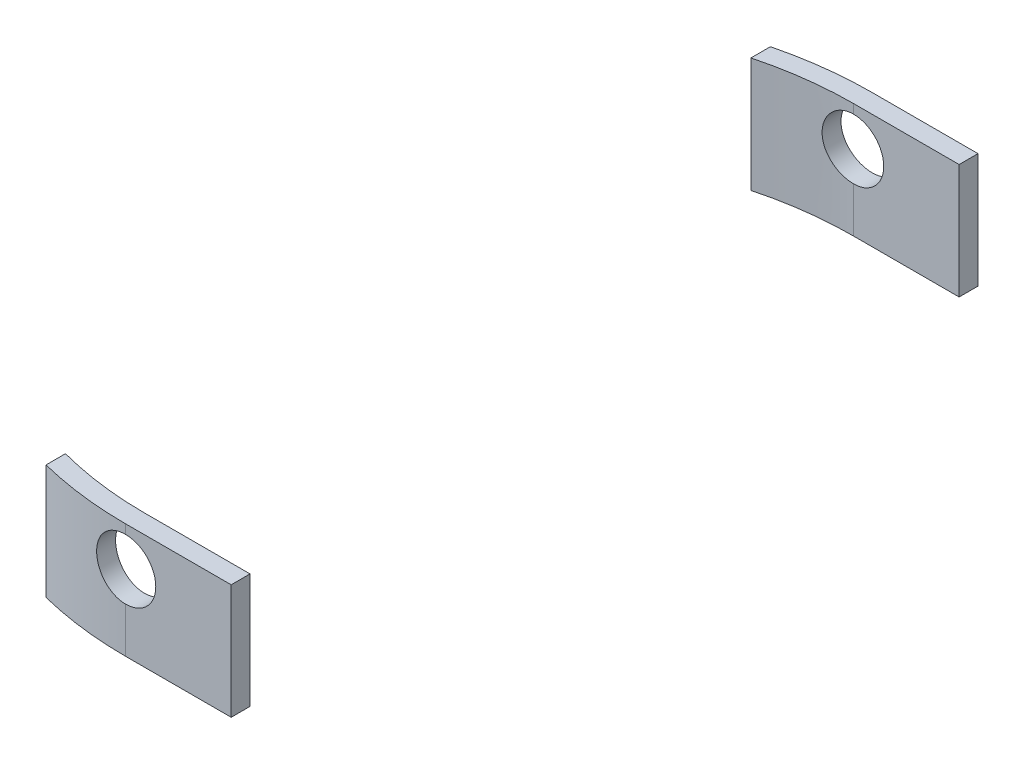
SolidWorks part; units mm, degrees
ref_plane "前视基准面" through (0, 0, 0) normal (0, 0, 1) x (1, 0, 0)
ref_plane "上视基准面" through (0, 0, 0) normal (0, 1, 0) x (1, 0, 0)
ref_plane "右视基准面" through (0, 0, 0) normal (1, 0, 0) x (0, 0, -1)
sketch "草图2" plane through (0, 0, 0) normal (0, 1, 0) x (1, 0, 0)
  line L1 (-25, 25) -> (25, 25)
  line L2 (-25, 25) -> (-25, -25)
  line L3 (-25, -25) -> (25, -25)
  line L4 (25, 25) -> (25, -25)
  line L5 (-25, 25) -> (25, -25) construction
  line L6 (-25, -25) -> (25, 25) construction
  point P0 (0, 0)
extrude "凸台-拉伸2" add sketch "草图2" along normal blind 2
extrude "切除-拉伸4" cut sketch "草图6" against normal up to surface (2 mm away)
sketch "草图6" plane through (19.5662, 2, 0) normal (0, 1, 0) x (1, 0, 0)
  line L0 (-19.5662, -18.5) -> (-11.9669, -18.5)
  line L2 (-11.9669, 18.5) -> (-19.5662, 18.5)
  line L8 (-51.0686, 28.8755) -> (17.3497, 28.8755)
  line L9 (-51.0686, 28.8755) -> (-51.0686, -33.6721)
  line L10 (-51.0686, -33.6721) -> (17.3497, -33.6721)
  line L11 (17.3497, 28.8755) -> (17.3497, -33.6721)
  arc A0 (-19.5662, -18.5) -> (-19.5662, 18.5) centre (-19.5662, 0) cw
  arc A1 (-11.9669, 18.5) -> (-11.9669, -18.5) centre (-19.5662, 0) cw
extrude "切除-拉伸5" cut sketch "草图7" against normal up to surface (2 mm away)
sketch "草图7" plane through (19.5662, 0, 0) normal (0, -1, 0) x (-1, 0, 0)
  line L1 (19.5662, 11.7491) -> (9.3912, 5.8745)
  line L2 (9.3912, 5.8745) -> (9.3912, -5.8745)
  line L3 (9.3912, -5.8745) -> (19.5662, -11.7491)
  line L4 (19.5662, -11.7491) -> (29.7412, -5.8745)
  line L5 (29.7412, -5.8745) -> (29.7412, 5.8745)
  line L6 (29.7412, 5.8745) -> (19.5662, 11.7491)
  circle A0 centre (19.5662, 0) radius 10.175 construction
sketch "草图8" plane through (0, 2, 0) normal (0, 1, 0) x (1, 0, 0)
  line L0 (12.375, 6.8) -> (12.375, -6.8)
  line L2 (0.2519, -13.973) -> (-11.5261, -7.173)
  line L4 (-11.5261, 7.173) -> (0.2519, 13.973)
  line L6 (10.175, 5.8745) -> (10.175, -5.8745) construction
  line L7 (-10.175, 5.8745) -> (0, 11.7491) construction
  line L8 (0, -11.7491) -> (-10.175, -5.8745) construction
  arc A0 (0.2519, -13.973) -> (12.375, -6.8) centre (0.4487, -0.4744) ccw
  arc A1 (12.375, 6.8) -> (0.2519, 13.973) centre (0.4487, 0.4744) ccw
  arc A2 (-11.5261, 7.173) -> (-11.5261, -7.173) centre (-0.6841, 0) ccw
  point P8 (10.175, 0)
  point P9 (12.375, 0)
  dimension "D7" = 13.5
  dimension "D8" = 13.5
  dimension "D9" = 13
  dimension "D1" = 13.6
  dimension "D2" = 13.6
  dimension "D3" = 13.6
  dimension "D4" = 2.2
  dimension "D5" = 1.8
  dimension "D6" = 1.8
extrude "切除-拉伸6" cut sketch "草图8" against normal blind 0.9
sketch "草图9" plane through (0, 2, 0) normal (0, 1, 0) x (1, 0, 0)
  line L0 (7.5993, 18.8) -> (0, 18.8)
  line L1 (7.5993, 18.5) -> (0, 18.5) construction
  line L2 (0, -18.8) -> (7.5993, -18.8)
  line L4 (0, 18.5) -> (7.5993, 18.5)
  line L5 (7.5993, -18.5) -> (0, -18.5)
  arc A0 (0, 18.8) -> (0, -18.8) centre (0, 0) ccw
  arc A1 (7.5993, 18.8) -> (7.5993, -18.8) centre (0, 0) cw
  arc A2 (0, 18.5) -> (0, -18.5) centre (0, 0) ccw
  arc A3 (7.5993, 18.5) -> (7.5993, -18.5) centre (0, 0) cw
  arc A10 (7.5993, -18.5) -> (7.5993, 18.5) centre (0, 0) ccw construction
  dimension "D1" = 0.3
extrude "凸台-拉伸3" add sketch "草图9" against normal up to surface (2 mm away)
sketch "草图11" plane through (0, 2, 0) normal (0, 1, 0) x (1, 0, 0)
  line L0 (7.5993, 19.8) -> (0, 19.8)
  line L2 (0, -19.8) -> (7.5993, -19.8)
  line L3 (7.5993, 18.8) -> (0, 18.8) construction
  line L4 (0, -18.8) -> (7.5993, -18.8) construction
  line L5 (0, 18.8) -> (7.5993, 18.8)
  line L6 (7.5993, -18.8) -> (0, -18.8)
  arc A0 (0, 19.8) -> (0, -19.8) centre (0, 0) ccw
  arc A1 (7.5993, -19.8) -> (7.5993, 19.8) centre (0, 0) ccw
  arc A2 (0, 18.8) -> (0, -18.8) centre (0, 0) ccw
  arc A3 (7.5993, 18.8) -> (7.5993, -18.8) centre (0, 0) cw
  arc A4 (7.5993, -18.8) -> (7.5993, 18.8) centre (0, 0) ccw construction
  dimension "D1" = 1
  dimension "D2" = 1
extrude "凸台-拉伸4" add sketch "草图11" along normal blind 16.3 and the other way up to surface (2 mm away)
sketch "草图12" plane through (0, 18.3, 0) normal (0, 1, 0) x (1, 0, 0)
  line L0 (0, -19.8) -> (7.5993, -19.8) construction
  line L1 (7.5993, 19.8) -> (5.5993, 19.8)
  line L2 (7.5993, 19.8) -> (7.5993, -19.8)
  line L3 (7.5993, -19.8) -> (5.5993, -19.8)
  line L4 (5.5993, 19.8) -> (5.5993, -19.8)
  dimension "D1" = 2
extrude "切除-拉伸8" cut sketch "草图12" against normal blind 11
sketch "草图13" plane through (0, 0, 0) normal (0, -1, 0) x (-1, 0, 0)
  circle A1 centre (-1, 0) radius 23
  circle A2 centre (-1, 0) radius 19.2348
  dimension "D1" = 1
extrude "凸台-拉伸5" add sketch "草图13" against normal blind 0.8
sketch "草图14" plane through (0, 0.8, 0) normal (0, 1, 0) x (1, 0, 0)
  circle A0 centre (1, 0) radius 22.4
  circle A1 centre (1, 0) radius 23
extrude "凸台-拉伸6" add sketch "草图14" along normal blind 4
extrude "切除-拉伸9" cut sketch "草图15" against normal blind 1.2
sketch "草图15" plane through (19.5662, 18.4506, -19.8) normal (0, 0, -1) x (-1, 0, 0)
  circle A0 centre (19.5662, -2.2381) radius 1.6
extrude "切除-拉伸10" cut sketch "草图16" against normal blind 1.2
sketch "草图16" plane through (19.5662, 18.4506, 19.8) normal (0, 0, 1) x (1, 0, 0)
  circle A0 centre (-19.5662, -2.2381) radius 1.6
sketch "草图17" plane through (0, 0, 0) normal (0, -1, 0) x (-1, 0, 0)
  circle A0 centre (0, 0) radius 14
  circle A1 centre (0, 0) radius 15
extrude "切除-拉伸11" cut sketch "草图17" against normal blind 0.6
sketch "草图18" plane through (0, 0, 0) normal (0, -1, 0) x (-1, 0, 0)
  circle A0 centre (-22, 0) radius 1.5
  dimension "D1" = 3
  dimension "D2" = 22
extrude "切除-拉伸12" cut sketch "草图18" against normal blind 0.7
sketch "草图19" plane through (0, 18.3, 0) normal (0, 1, 0) x (1, 0, 0)
  line L0 (0, 0) -> (7.7098, 23.3639)
  line L1 (7.7098, 23.3639) -> (27.1211, 11.7749)
  line L2 (27.1211, 11.7749) -> (0, 0)
  line L3 (0, 0) -> (28.0715, -11.7877)
  line L4 (28.0715, -11.7877) -> (8.0713, -24.5647)
  line L5 (8.0713, -24.5647) -> (0, 0)
extrude "切除-拉伸13" cut sketch "草图19" against normal blind 8 contours L3 L4 L5 | L0 L1 L2
sketch "草图20" plane through (0, 0, 0) normal (0, -1, 0) x (1, 0, 0)
  circle A0 centre (0, 0) radius 16.5
  circle A1 centre (0, 0) radius 17
extrude "凸台-拉伸7" add sketch "草图20" along normal blind 3
sketch "草图21" plane through (0, 0, 19.8) normal (0, 0, 1) x (1, 0, 0)
  line L0 (-25.8445, 12.2142) -> (-25.8445, 21.6132)
  line L1 (-25.8445, -5.5018) -> (26.7965, -5.5018)
  line L2 (-25.8445, -5.5018) -> (-25.8445, 12.2142)
  line L3 (-4.8152, 12.2142) -> (12.7318, 12.2142)
  line L4 (26.7965, -5.5018) -> (26.7965, 12.2142)
  line L5 (-25.8445, 21.6132) -> (-4.8152, 21.6132)
  line L6 (-4.8152, 21.6132) -> (-4.8152, 12.2142)
  line L7 (26.7965, 12.2142) -> (26.7965, 22.0189)
  line L8 (26.7965, 22.0189) -> (12.7318, 22.0189)
  line L9 (12.7318, 22.0189) -> (12.7318, 12.2142)
extrude "切除-拉伸14" cut sketch "草图21" against normal mid plane 100
